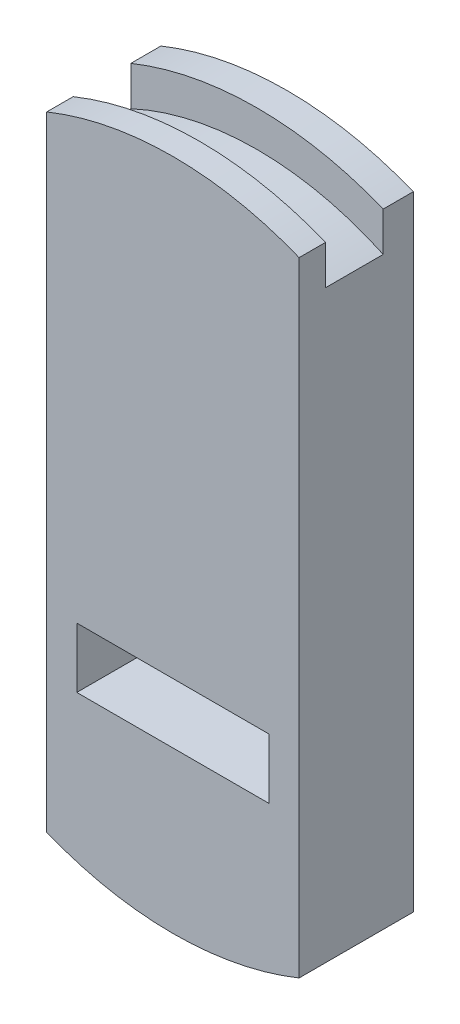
SolidWorks part; units mm, degrees
ref_plane "前视基准面" through (0, 0, 0) normal (0, 0, 1) x (1, 0, 0)
ref_plane "上视基准面" through (0, 0, 0) normal (0, 1, 0) x (1, 0, 0)
ref_plane "右视基准面" through (0, 0, 0) normal (1, 0, 0) x (0, 0, -1)
sketch "草图1" plane through (0, 0, 0) normal (0, 0, 1) x (1, 0, 0)
  circle A0 centre (0, 0) radius 25
extrude "凸台-拉伸2" add sketch "草图1" along normal blind 9.8
sketch "草图2" plane through (0, 0, 9.8) normal (0, 0, 1) x (1, 0, 0)
  line L0 (-10.75, 29.7673) -> (-10.75, -29.7673)
  line L1 (10.75, 29.7673) -> (10.75, -29.7673)
  arc A0 (-10.75, 29.7673) -> (-10.75, -29.7673) centre (0, 0) ccw
  arc A1 (10.75, -29.7673) -> (10.75, 29.7673) centre (0, 0) ccw
extrude "切除-拉伸1" cut sketch "草图2" against normal blind 9.8
sketch "草图3" plane through (0, 0, 9.8) normal (0, 0, 1) x (1, 0, 0)
  line L0 (-8, -9.6274) -> (8, -9.6274)
  line L13 (-8, -14.6274) -> (8, -14.6274)
  line L19 (-25.4838, -9.6274) -> (25.4093, -9.6274) construction
  line L20 (-25.4838, -14.6274) -> (25.4093, -14.6274) construction
  line L28 (-8, -9.6274) -> (-8, -14.6274)
  line L30 (8, -9.6274) -> (8, -14.6274)
  dimension "D5" = 5
extrude "切除-拉伸2" cut sketch "草图3" against normal blind 10
sketch "草图4" plane through (0, 0, 9.8) normal (0, 0, 1) x (1, 0, 0)
  circle A0 centre (0, 0) radius 25
  circle A1 centre (0, 0) radius 28
extrude "凸台-拉伸3" add sketch "草图4" against normal blind 2.5
sketch "草图5" plane through (0, 0, 0) normal (0, 0, -1) x (-1, 0, 0)
  circle A0 centre (0, 0) radius 25
  circle A1 centre (0, 0) radius 28
extrude "凸台-拉伸4" add sketch "草图5" against normal blind 2.5
sketch "草图6" plane through (0, 0, 9.8) normal (0, 0, 1) x (1, 0, 0)
  line L0 (-10.75, 30.6359) -> (-10.75, -30.6359)
  line L1 (10.75, 30.6359) -> (10.75, -30.6359)
  arc A0 (-10.75, 30.6359) -> (-10.75, -30.6359) centre (0, 0) ccw
  arc A1 (10.75, -30.6359) -> (10.75, 30.6359) centre (0, 0) ccw
extrude "切除-拉伸3" cut sketch "草图6" against normal blind 20
sketch "草图7" plane through (0, 0, 9.8) normal (0, 0, 1) x (1, 0, 0)
  line L3 (10.75, -20.9184) -> (10.75, -25.8542)
  line L4 (-10.75, -20.9184) -> (10.75, -20.9184)
  line L6 (-10.75, -20.9184) -> (-10.75, -25.8542)
  arc A1 (-10.75, -25.8542) -> (10.75, -25.8542) centre (0, 0) ccw
extrude "凸台-拉伸5" add sketch "草图7" against normal blind 8
sketch "草图8" plane through (0, 0, 9.8) normal (0, 0, 1) x (1, 0, 0)
  line L0 (-10.5, 33.0823) -> (-10.5, -29.4721)
  line L1 (10.5, 33.0823) -> (10.5, -29.4721)
  arc A0 (-10.5, 33.0823) -> (-10.5, -29.4721) centre (0, 1.8051) ccw
  arc A1 (10.5, -29.4721) -> (10.5, 33.0823) centre (0, 1.8051) ccw
extrude "切除-拉伸4" cut sketch "草图8" against normal blind 15
sketch "草图9" plane through (10.5, 0, 0) normal (1, 0, 0) x (0, 0, -1)
  line L1 (-9.5, 31.8895) -> (-9.5, -30.9268)
  line L5 (-20.7846, 31.8895) -> (-9.5, 31.8895)
  line L6 (-20.7846, 31.8895) -> (-20.7846, -30.9268)
  line L7 (-20.7846, -30.9268) -> (-9.5, -30.9268)
extrude "切除-拉伸5" cut sketch "草图9" against normal blind 60
